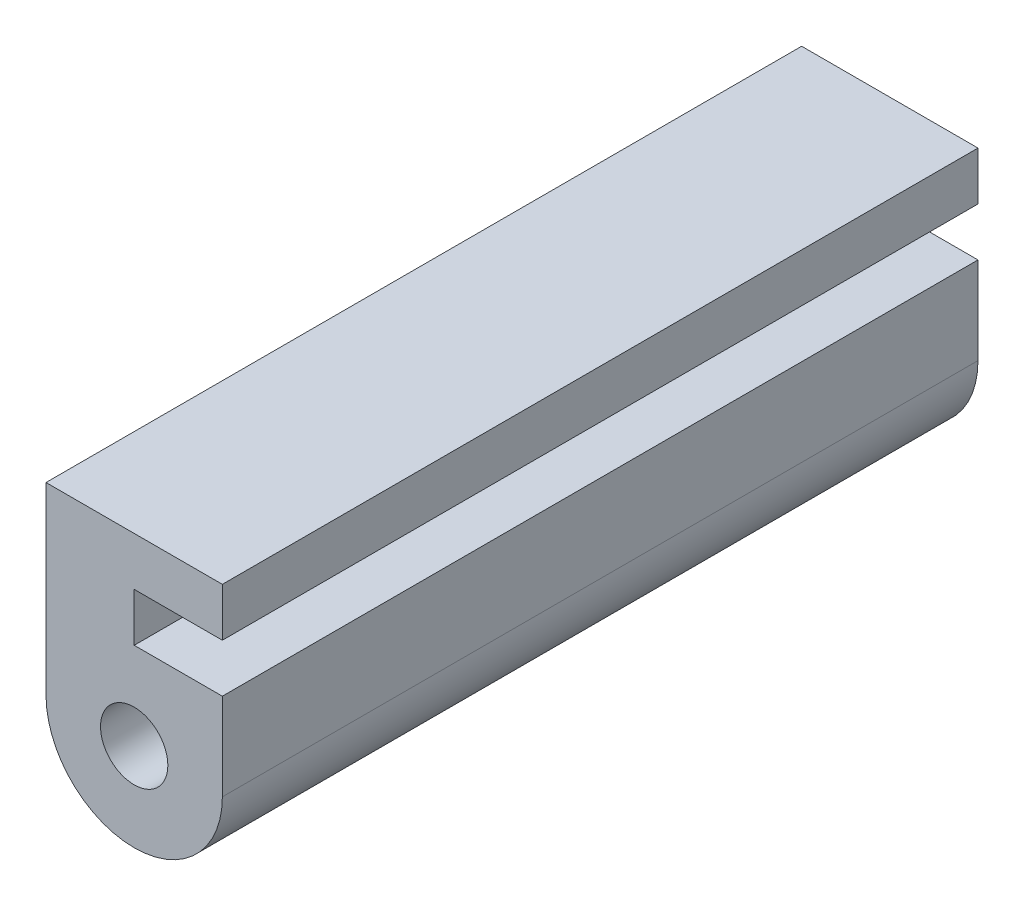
SolidWorks part; units mm, degrees
ref_plane "Front Plane" through (0, 0, 0) normal (0, 0, 1) x (1, 0, 0)
ref_plane "Top Plane" through (0, 0, 0) normal (0, 1, 0) x (1, 0, 0)
ref_plane "Right Plane" through (0, 0, 0) normal (1, 0, 0) x (0, 0, -1)
sketch "Sketch1" plane through (0, 0, 0) normal (0, 0, 1) x (1, 0, 0)
  line L0 (-9.1022, 0) -> (-9.1022, 19)
  line L1 (9.1022, 0) -> (9.1022, 9)
  line L2 (9.1022, 19) -> (-9.1022, 19)
  line L3 (0, 0) -> (0, 9.1022) construction
  line L4 (-9.1022, 14) -> (9.1022, 14) construction
  line L5 (0, 9.1022) -> (0, 14) construction
  line L6 (5.0022, 11.5511) -> (0, 11.5511) construction
  line L7 (9.1022, 14) -> (9.1022, 19)
  line L8 (9.1022, 9) -> (0.0022, 9)
  line L10 (9.1022, 14) -> (0.0022, 14)
  line L11 (0.0022, 9) -> (0.0022, 14)
  line L12 (5.0022, 11.5511) -> (0.0022, 14) construction
  line L13 (5.0022, 11.5511) -> (0.0022, 9) construction
  circle A0 centre (0, 0) radius 3.475
  arc A1 (-9.1022, 0) -> (9.1022, 0) centre (0, 0) ccw
  circle A2 centre (0, 0) radius 9.1022 construction
extrude "Boss-Extrude1" add sketch "Sketch1" along normal blind 78
equation "\"D3@Sketch1\"=\"TraySurface.thickness\""
equation "\"D5@Sketch1\"=\"AxleCenterToTrayLowerSurface\""
equation "\"D6@Sketch1\" = \"AxleHousing.notchDepth\""
equation "\"D1@Sketch1\" = \"Axle.holeDiameter\""
equation "\"                              Base.FrontPlate            \"= 0"
equation "\"protractor.radius\"= 76.5"
equation "\"protractor.baseHeight\"= 8.5"
equation "\"protractor.thickness\" = 1"
equation "\"inlay.clearance\"= 1 ' clearance on radius, i.e. twice this on resulting diameter"
equation "\"inlay.radius\" = \"protractor.radius\"+\"inlay.clearance\""
equation "\"inlay.baseHeight\"=\"protractor.baseHeight\"+\"inlay.clearance\""
equation "\"inlay.thickness\" = 5"
equation "\"FrontPlate.margin\" = 4"
equation "\"FrontPlate.radius\"=\"inlay.radius\"+\"FrontPlate.margin\""
equation "\"FrontPlate.baseHeight\" = \"inlay.baseHeight\"+\"FrontPlate.margin\""
equation "\"FrontPlate.thickness\" = \"inlay.thickness\" + \"protractor.thickness\""
equation "\"                             Base.Base            \"= 0"
equation "\"Base.innerWidth\" = 80 ' from inner face of each plate"
equation "\"Base.thickness\" = 5"
equation "\"Base.height\" = 40 ' from bottom of side plate to top of base surface"
equation "\"Base.legHeight\" = \"Base.height\"+\"FrontPlate.baseHeight\"+\"AxleCenterToTrayLowerSurface\""
equation "\"Base.backLegHeight\" = \"Base.height\"+\"FrontPlate.baseHeight\"-\"AxleCenterToTrayLowerSurface\"-\"TraySurface.thickness\""
equation "\"                              Tray             \"= 0"
equation "\"TraySurface.length\" = 205"
equation "\"TraySurface.thickness\" = 5"
equation "\"                              Axle and AxleHousing         \"= 0"
equation "\"Axle.length\" = \"Base.InnerWidth\"+\"FrontPlate.holeDepth\" + \"FrontPlate.thickness\""
equation "\"Axle.Diameter\" = 6.35"
equation "\"Axle.holeDiameter\" = \"Axle.Diameter\"+0.6 "
equation "\"AxleCenterToTrayLowerSurface\" = 9"
equation "\"AxleHousing.notchDepth\" = 9.10"
equation "\"                              TrayPlate                \"= 0"
equation "\"SteelProtractor.radius\" = 45"
equation "\"SteelProtractor.baseHeight\" = 7"
equation "\"SteelProtractor.thickness\" = 1.2"
equation "\"TrayPlate.clearance\" = 0.7"
equation "\"TrayPlate.innerRadius\" = \"SteelProtractor.radius\"+\"TrayPlate.clearance\""
equation "\"TrayPlate.baseHeight\" = \"SteelProtractor.baseHeight\"+\"TrayPlate.clearance\""
equation "\"TrayPlate.margin\" = 2"
equation "\"TrayPlate.thickness\" = 4"
equation "\"TrayPlate.inlayThickness\" = \"TrayPlate.thickness\" - \"SteelProtractor.thickness\""
equation "\"TrayPlate.outerDiameter\" = \"TrayPlate.outerRadius\"*2"
equation "\"                              VARIA             \"= 0"
equation "\"BrassInsert.diameter\" = 5.6"
equation "\"D1@Boss-Extrude1\"=\"Base.innerWidth\"-2"
